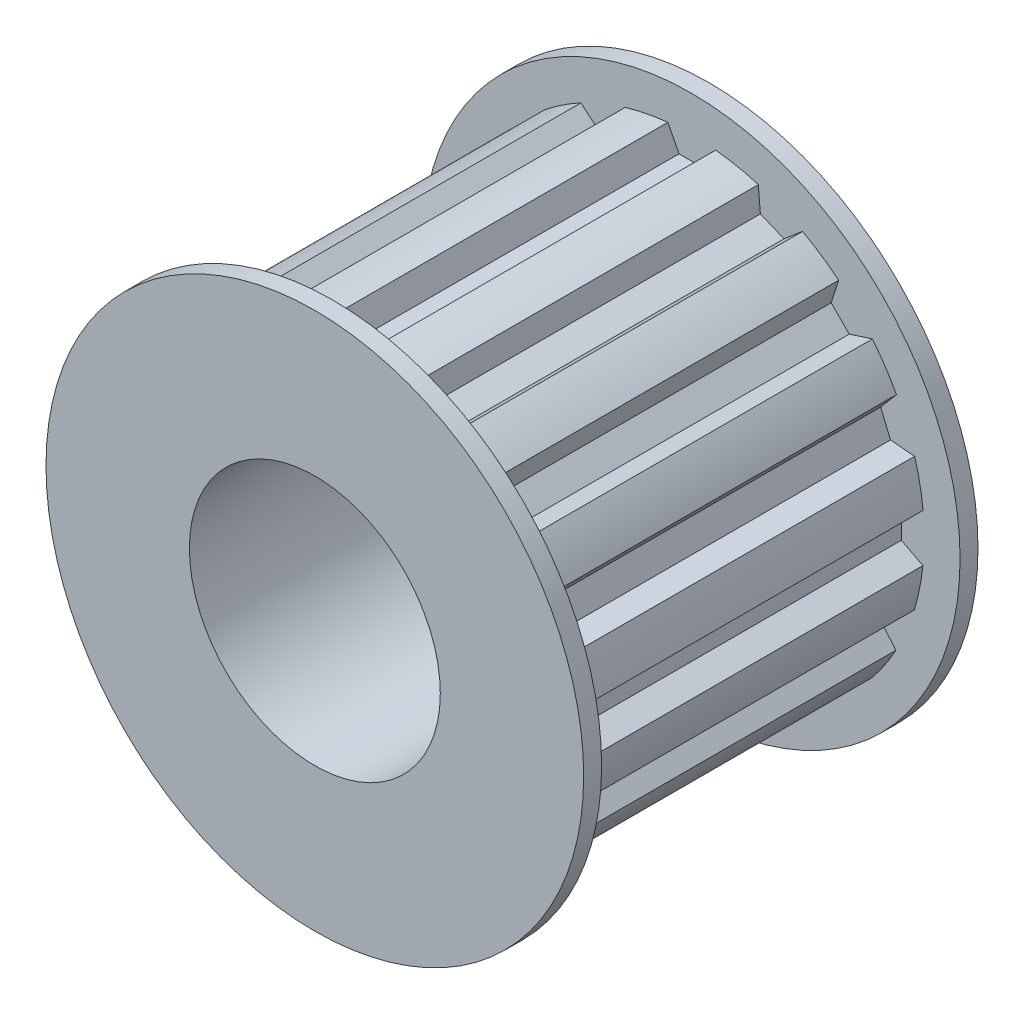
SolidWorks part; units mm, degrees
ref_plane "Plan de face" through (0, 0, 0) normal (0, 0, 1) x (1, 0, 0)
ref_plane "Plan de dessus" through (0, 0, 0) normal (0, 1, 0) x (1, 0, 0)
ref_plane "Plan de droite" through (0, 0, 0) normal (1, 0, 0) x (0, 0, -1)
sketch "Esquisse1" plane through (0, 0, 0) normal (0, 0, 1) x (1, 0, 0)
  circle A0 centre (0, 0) radius 13
extrude "Boss.-Extru.1" add sketch "Esquisse1" along normal blind 20
sketch "Esquisse2" plane through (0, 0, 20) normal (0, 0, 1) x (1, 0, 0)
  line L1 (-1.4668, 13.25) -> (1.5332, 13.25)
  line L2 (-1.4668, 13.25) -> (-0.6807, 11.7236)
  line L3 (-0.6807, 11.7236) -> (0.747, 11.7236)
  line L4 (1.5332, 13.25) -> (0.747, 11.7236)
  dimension "D1" = 3
extrude "Enlèv. mat.-Extru.1" cut sketch "Esquisse2" against normal blind 20
pattern_circular "Répétition circulaire1" count 16 over 360 about axis through (0, 0, 0) along (0, 0, 1) of "Enlèv. mat.-Extru.1"
sketch "Esquisse3" plane through (0, 0, 20) normal (0, 0, 1) x (1, 0, 0)
  circle A0 centre (0, 0) radius 15
extrude "Boss.-Extru.2" add sketch "Esquisse3" along normal blind 1
sketch "Esquisse4" plane through (0, 0, 0) normal (0, 0, -1) x (-1, 0, 0)
  circle A0 centre (0, 0) radius 15
extrude "Boss.-Extru.3" add sketch "Esquisse4" along normal blind 1
sketch "Esquisse5" plane through (0, 0, -1) normal (0, 0, -1) x (-1, 0, 0)
  circle A0 centre (0, 0) radius 7
extrude "Enlèv. mat.-Extru.2" cut sketch "Esquisse5" against normal up to next contours A0
